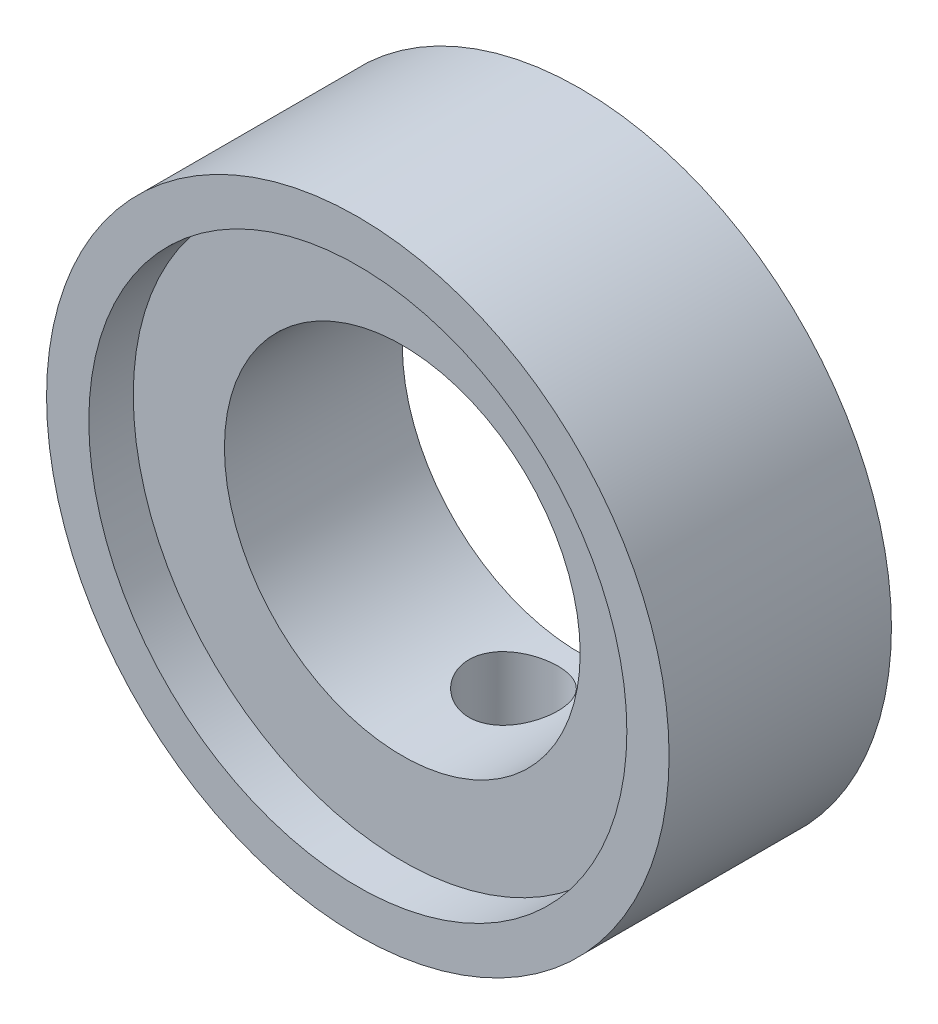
SolidWorks part; units mm, degrees
ref_plane "Přední rovina" through (0, 0, 0) normal (0, 0, 1) x (1, 0, 0)
ref_plane "Horní rovina" through (0, 0, 0) normal (0, 1, 0) x (1, 0, 0)
ref_plane "Pravá rovina" through (0, 0, 0) normal (1, 0, 0) x (0, 0, -1)
sketch "Skica1" plane through (0, 0, 0) normal (0, 0, 1) x (1, 0, 0)
  circle A0 centre (0, 0) radius 126.95
  circle A1 centre (0, 0) radius 122.5
  dimension "D1" = 253.9
  dimension "D2" = 245
extrude "Přidat vysunutím1" add sketch "Skica1" along normal blind 5
sketch "Skica2" plane through (0, 0, 5) normal (0, 0, 1) x (1, 0, 0)
  circle A0 centre (0, 0) radius 122.5
  circle A1 centre (0, 0) radius 137
  dimension "D1" = 245
  dimension "D2" = 274
extrude "Přidat vysunutím2" add sketch "Skica2" along normal blind 38 separate body
sketch "Skica3" plane through (0, 0, 43) normal (0, 0, 1) x (1, 0, 0)
  circle A0 centre (0, 0) radius 137
  circle A1 centre (0, 0) radius 25.25
  dimension "D1" = 50.5
extrude "Přidat vysunutím3" add sketch "Skica3" against normal blind 5
sketch "Skica4" plane through (0, 0, 43) normal (0, 0, 1) x (1, 0, 0)
  circle A0 centre (0, 0) radius 20
  circle A1 centre (0, 0) radius 35
  dimension "D1" = 70
  dimension "D2" = 40
extrude "Přidat vysunutím4" add sketch "Skica4" along normal blind 25
sketch "Skica5" plane through (0, 0, 68) normal (0, 0, 1) x (1, 0, 0)
  circle A0 centre (0, 0) radius 30.25
  dimension "D1" = 60.5
extrude "Odebrat vysunutím1" cut sketch "Skica5" against normal blind 5
sketch "Skica6" plane through (0, 0, 43) normal (0, 0, 1) x (1, 0, 0)
  line L0 (0, 137) -> (0, -137) construction
  line L1 (-137, 0) -> (137, 0) construction
  line L2 (9.07, -135) -> (-9.07, -135)
  line L3 (-9.07, -135) -> (-9.07, -128.81)
  line L4 (9.07, -135) -> (9.07, -128.81)
  line L5 (-9.07, -128.81) -> (9.07, -128.81)
  circle A0 centre (0, 0) radius 137 construction
  circle A1 centre (0, 0) radius 135 construction
  point P14 (0, -135)
  dimension "D1" = 270
  dimension "D2" = 9.07
  dimension "D3" = 6.19
extrude "Odebrat vysunutím2" cut sketch "Skica6" against normal blind 65
sketch "Skica8" plane through (0, 0, 0) normal (0, 1, 0) x (1, 0, 0)
  line L0 (-35, -43) -> (35, -43) construction
  line L1 (0, 0) -> (0, -50.5) construction
  circle A0 centre (0, -50.5) radius 5
  dimension "D3" = 10
  dimension "D1" = 43
  dimension "D2" = 50.5
extrude "Odebrat vysunutím3" cut sketch "Skica8" against normal blind 65
sketch "Skica9" plane through (0, 0, 38) normal (0, 0, -1) x (-1, 0, 0)
  circle A0 centre (0, 0) radius 40
  circle A1 centre (0, 0) radius 45
  dimension "D1" = 80
  dimension "D2" = 90
extrude "Přidat vysunutím5" add sketch "Skica9" along normal blind 18
sketch "Skica12" plane through (0, 0, 20) normal (0, 0, -1) x (-1, 0, 0)
  circle A0 centre (0, 0) radius 45
  circle A1 centre (0, 0) radius 25
  dimension "D1" = 90
  dimension "D2" = 50
extrude "Přidat vysunutím7" [suppressed] add sketch "Skica12" along normal blind 5
scale "Měřítko1" bodies to scale 101 114 scale about origin uniform scaling yes scale factor 0.655
sketch "Skica14" plane through (0, 0, 28.165) normal (0, 0, 1) x (1, 0, 0)
  circle A0 centre (0, 0) radius 165.5762
extrude "Odebrat vysunutím5" cut sketch "Skica14" against normal through all
